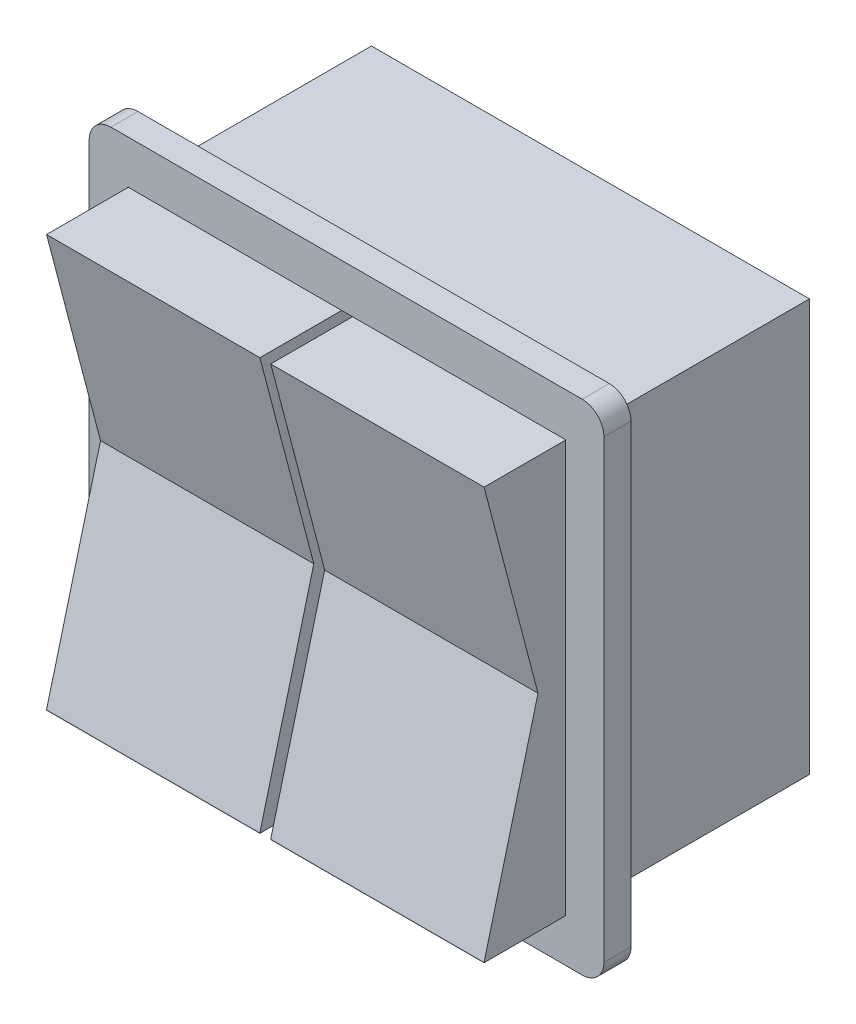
SolidWorks part; units mm, degrees
ref_plane "Front Plane" through (0, 0, 0) normal (0, 0, 1) x (1, 0, 0)
ref_plane "Top Plane" through (0, 0, 0) normal (0, 1, 0) x (1, 0, 0)
ref_plane "Right Plane" through (0, 0, 0) normal (1, 0, 0) x (0, 0, -1)
sketch "Sketch1" plane through (0, 0, 0) normal (0, 0, 1) x (1, 0, 0)
  line L1 (-25.654, -24.13) -> (25.654, -24.13)
  line L2 (-25.654, -24.13) -> (-25.654, 24.13)
  line L3 (-25.654, 24.13) -> (25.654, 24.13)
  line L4 (25.654, -24.13) -> (25.654, 24.13)
  line L5 (-25.654, -24.13) -> (25.654, 24.13) construction
  line L6 (-25.654, 24.13) -> (25.654, -24.13) construction
  point P0 (0, 0)
extrude "Boss-Extrude1" add sketch "Sketch1" along normal blind 25.4
sketch "Sketch2" plane through (0, 0, 25.4) normal (0, 0, 1) x (1, 0, 0)
  line L1 (-27.6098, -29.21) -> (27.6098, -29.21)
  line L2 (-30.1498, -26.67) -> (-30.1498, 26.67)
  line L3 (-27.6098, 29.21) -> (27.6098, 29.21)
  line L4 (30.1498, -26.67) -> (30.1498, 26.67)
  line L5 (-30.1498, -29.21) -> (30.1498, 29.21) construction
  line L6 (-30.1498, 29.21) -> (30.1498, -29.21) construction
  line L7 (-25.654, 24.13) -> (25.654, 24.13)
  line L8 (-25.654, 24.13) -> (-25.654, -24.13)
  line L9 (-25.654, -24.13) -> (25.654, -24.13)
  line L10 (25.654, 24.13) -> (25.654, -24.13)
  arc A0 (-27.6098, -29.21) -> (-30.1498, -26.67) centre (-27.6098, -26.67) cw
  arc A1 (27.6098, -29.21) -> (30.1498, -26.67) centre (27.6098, -26.67) ccw
  arc A2 (-27.6098, 29.21) -> (-30.1498, 26.67) centre (-27.6098, 26.67) ccw
  arc A3 (27.6098, 29.21) -> (30.1498, 26.67) centre (27.6098, 26.67) cw
  point P0 (0, 0)
  dimension "D1" = 2.54
  dimension "D2" = 60.2996
  dimension "D3" = 58.42
extrude "Boss-Extrude2" add sketch "Sketch2" along normal blind 3.175 separate body
sketch "Sketch3" plane through (0, 0, 25.4) normal (0, 0, 1) x (1, 0, 0)
  line L15 (0.6455, -24.188) -> (0.6455, 24.072)
  line L16 (0.6455, -24.188) -> (25.6379, -24.188)
  line L17 (25.6379, -24.188) -> (25.6379, 24.072)
  line L18 (0.6455, 24.072) -> (25.6379, 24.072)
  line L19 (-25.6187, -24.188) -> (-25.6187, 24.072)
  line L20 (-25.6187, -24.188) -> (-0.6263, -24.188)
  line L21 (-0.6263, -24.188) -> (-0.6263, 24.072)
  line L22 (-25.6187, 24.072) -> (-0.6263, 24.072)
  point P0 (0, 0)
extrude "Boss-Extrude5" add sketch "Sketch3" along normal blind 12.7 separate body
sketch "Sketch4" plane through (-25.6187, 0, 0) normal (-1, 0, 0) x (0, 0, 1)
  line L0 (38.1, 24.072) -> (38.1, -24.13)
  line L1 (38.1, 24.072) -> (38.1, -24.188) construction
  line L2 (31.784, 0) -> (38.1, 24.072)
  line L3 (31.784, 0) -> (38.1, -24.13)
extrude "Cut-Extrude1" cut sketch "Sketch4" against normal blind 254
